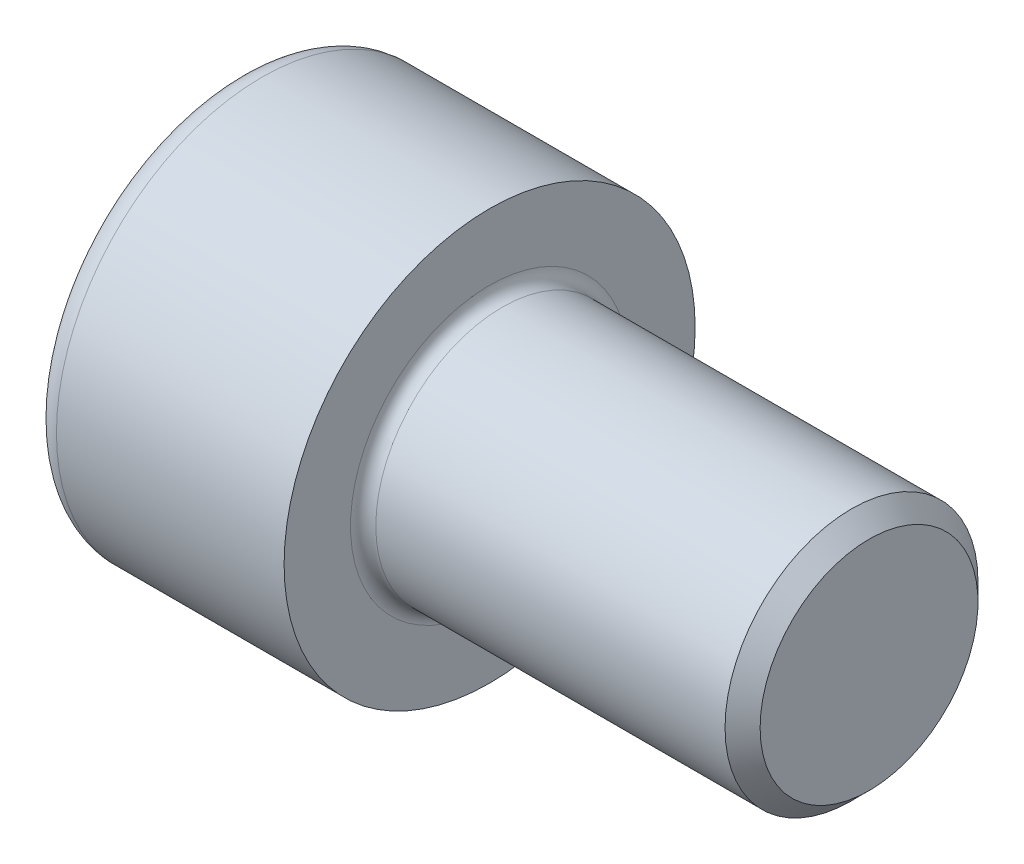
SolidWorks part; units mm, degrees
revolve "Base-Revolve" add sketch "BodySke"
sketch "BodySke" plane through (0, 0, 0) normal (0, 0, 1) x (1, 0, 0)
  line L0 (0, 0) -> (0, 6.5)
  line L1 (0, 6.5) -> (8, 6.5)
  line L2 (8, 6.5) -> (8, 4)
  line L3 (8, 4) -> (19.4455, 4)
  line L4 (20, 3.4455) -> (20, 0)
  line L5 (20, 0) -> (0, 0)
  line L6 (-31.75, 0) -> (127, 0) construction
  line L8 (20, 3.4455) -> (19.4455, 4)
  line L10 (20, -3.4455) -> (19.4455, -4) construction
  line L11 (9, 9.525) -> (9, 3.175) construction
  line L12 (8, 9.525) -> (8, 3.175) construction
  line L13 (-40, 9.525) -> (-40, 3.175) construction
fillet "Fillet1" radius 0.4 1 edges at (8, 0, 4)
fillet "Fillet2" radius 0.8 1 edges at (0, 0, 6.5)
ref_plane "Plane1" through (0, 0, 0) normal (0, 0, 1) x (1, 0, 0)
ref_plane "Plane2" through (0, 0, 0) normal (0, 1, 0) x (1, 0, 0)
ref_plane "Plane3" through (0, 0, 0) normal (1, 0, 0) x (0, 0, -1)
sketch "Sketch2" plane through (0, 0, 0) normal (0, 0, 1) x (1, 0, 0)
  line L0 (0, 3.01) -> (4, 3.01)
  line L1 (4, 3.01) -> (5.7378, 0)
  line L2 (-31.75, 0) -> (127, 0) construction
  line L3 (5.7378, 0) -> (0, 0)
  line L4 (0, 0) -> (0, 3.01)
  line L6 (0, 0) -> (47.625, 0) construction
revolve "Hex-PreBroach" cut sketch "Sketch2" angle 360 about L6
sketch "Sketch3" plane through (0, 0, 0) normal (-1, 0, 0) x (0, 0.5, 0.866)
  line L0 (1.7378, 3.01) -> (-1.7378, 3.01)
  line L1 (-1.7378, 3.01) -> (-3.4756, 0)
  line L2 (1.7378, 3.01) -> (3.4756, 0)
  line L3 (1.7378, -3.01) -> (3.4756, 0)
  line L4 (1.7378, -3.01) -> (-1.7378, -3.01)
  line L5 (-1.7378, -3.01) -> (-3.4756, 0)
extrude "Hex" cut sketch "Sketch3" against normal blind 4
sketch "ThdSchSke" plane through (0, 0, 0) normal (0, 0, 1) x (1, 0, 0)
  line L0 (11, -3.4455) -> (10.6117, -4)
  line L1 (11, -3.4455) -> (11.3883, -4)
  line L2 (11.3883, -4) -> (11.3883, -5)
  line L3 (-3.175, 0) -> (5.1513, 0) construction
  line L4 (0, 5.7) -> (0, -5.7) construction
  line L5 (11.3883, -5) -> (10.6117, -5)
  line L6 (10.6117, -5) -> (10.6117, -4)
revolve "ThreadSchematic" [suppressed] cut sketch "ThdSchSke" angle 360 about L3
pattern_linear "ThdSchPat" [suppressed]
equation "\"D2@Sketch3\" = \"Hex_size@Sketch3\" / 2"
equation "\"D1@Sketch3\" = \"Hex_size@Sketch3\" / 2"
equation "\"D1@Sketch2\" = \"Hex_size@Sketch3\" / 2"
equation "\"Thread_minor@ThreadCosmetic\"  =  \"Minor_dia@BodySke\""
equation "\"Depth@Sketch2\" =  \"Key_eng@Hex\""
equation "\"Thread_length@ThreadCosmetic\" = ((sgn( (\"Length@BodySke\" - \"Advance@BodySke\" * 3.0) - \"Thread_nom@BodySke\" )-1)*( (\"Length@BodySke\" - \"Advance@BodySke\" * 3.0) - \"Thread_nom@BodySke\" ))/-2+ \"Thread_no"
equation "\"Thread_minor@ThdSchSke\" = \"Minor_dia@BodySke\""
equation "\"Diameter@ThdSchSke\" = \"Diameter@BodySke\""
equation "\"Overcut@ThdSchSke\" = \"Diameter@BodySke\" * 1.25"
equation "\"Start@ThdSchSke\" = \"Head_ht@BodySke\" + \"Length@BodySke\" - \"Thread_length@ThreadCosmetic\"  '---Non-countersunk---"
equation "\"Num_threads@ThdSchPat\" = int( \"Thread_length@ThreadCosmetic\" / \"Advance@BodySke\" + 0.999 )  + 1"
equation "\"Advance@ThdSchPat\" = \"Thread_length@ThreadCosmetic\" /  (\"Num_threads@ThdSchPat\" - 1) 'relax it"
equation "\"Num_threads@ThdSchPat\" = \"Num_threads@ThdSchPat\" - sgn( \"Num_threads@ThdSchPat\" - 1) '---chamfered tips only---"
